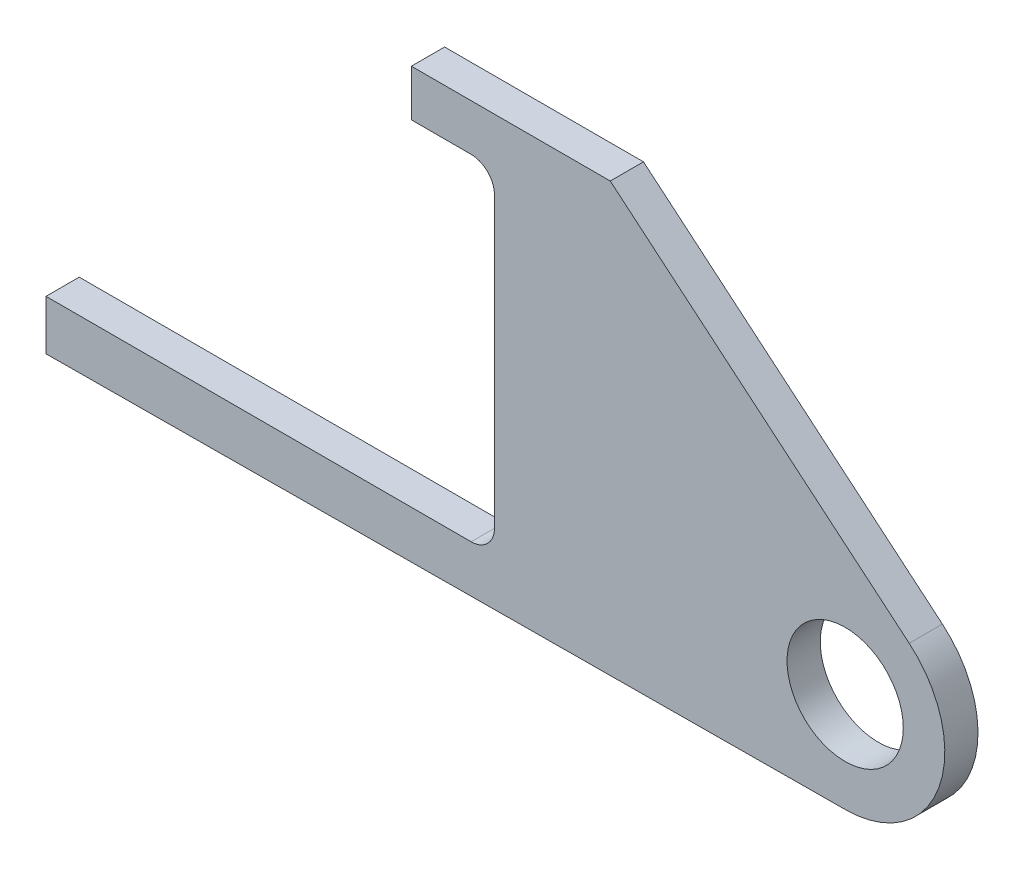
SolidWorks part; units mm, degrees
ref_plane "Plan de face" through (0, 0, 0) normal (0, 0, 1) x (1, 0, 0)
ref_plane "Plan de dessus" through (0, 0, 0) normal (0, 1, 0) x (1, 0, 0)
ref_plane "Plan de droite" through (0, 0, 0) normal (1, 0, 0) x (0, 0, -1)
sketch "Esquisse1" plane through (0, 0, 0) normal (0, 0, 1) x (1, 0, 0)
  line L0 (-481.18, -33) -> (-225.18, -33)
  line L1 (-211.18, -19) -> (-211.18, 155)
  line L3 (-141.432, 197) -> (38.5673, 45.9627)
  line L4 (0.3739, -59.9988) -> (-481.18, -63)
  line L5 (-481.18, -33) -> (-481.18, -63)
  line L6 (-225.18, 169) -> (-261.18, 169)
  line L7 (-261.18, 169) -> (-261.18, 197)
  line L8 (-261.18, 197) -> (-141.432, 197)
  arc A0 (38.5673, 45.9627) -> (0.3739, -59.9988) centre (0, 0) cw
  circle A1 centre (0, 0) radius 35
  arc A2 (-211.18, 155) -> (-225.18, 169) centre (-225.18, 155) ccw
  arc A3 (-225.18, -33) -> (-211.18, -19) centre (-225.18, -19) ccw
  point P9 (60, 0)
  point P15 (-211.18, 169)
  point P18 (-211.18, -33)
  dimension "D7" = 60
  dimension "D8" = 70
  dimension "D12" = 14
  dimension "D1" = 211.18
  dimension "D2" = 33
  dimension "D3" = 30
  dimension "D4" = 202
  dimension "D5" = 50
  dimension "D6" = 270
  dimension "D9" = 541.18
  dimension "D10" = 140
  dimension "D11" = 28
extrude "Extrusion1" add sketch "Esquisse1" along normal blind 20
